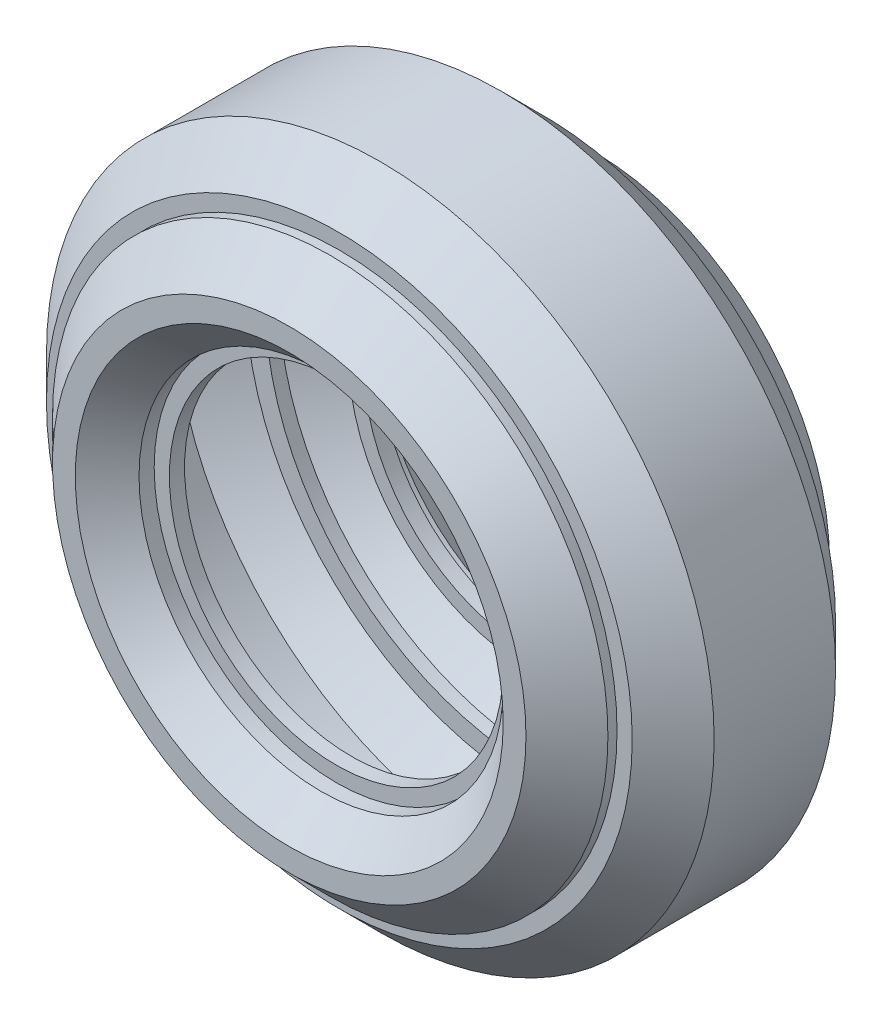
SolidWorks part; units mm, degrees
ref_plane "Front Plane" through (0, 0, 0) normal (0, 0, 1) x (1, 0, 0)
ref_plane "Top Plane" through (0, 0, 0) normal (0, 1, 0) x (1, 0, 0)
ref_plane "Right Plane" through (0, 0, 0) normal (1, 0, 0) x (0, 0, -1)
sketch "Sketch1" plane through (0, 0, 0) normal (0, 1, 0) x (1, 0, 0)
  line L0 (-7.62, 3.81) -> (0, 3.81)
  line L1 (-7.62, -3.81) -> (0, -3.81)
  circle A0 centre (0, 0) radius 2.286 construction
  arc A1 (0, -3.81) -> (0, 3.81) centre (0, 0) ccw
  arc A2 (-7.62, 3.81) -> (-7.62, -3.81) centre (-7.62, 0) ccw
  dimension "D1" = 7.62
  dimension "D2" = 4.572
  dimension "D3" = 7.62
extrude "Extrude1" add sketch "Sketch1" along normal blind 3.81
ref_plane "Plane1" through (0, 0, 3.81) normal (0, 0, 1) x (1, 0, 0)
sketch "Sketch4" plane through (0, 0, 3.81) normal (0, 0, 1) x (1, 0, 0)
  line L0 (0, 0) -> (0, 3.81)
  line L2 (0, 3.81) -> (7.62, 3.81)
  line L4 (7.62, 0) -> (0, 0)
  line L5 (7.62, 0) -> (11.43, 0)
  arc A0 (11.43, 0) -> (7.62, 3.81) centre (7.62, 0) ccw
  dimension "D2" = 3.81
  dimension "D1" = 7.62
extrude "Extrude2" add sketch "Sketch4" against normal blind 0.508
sketch "Sketch6" plane through (0, 0, 3.81) normal (0, 0, 1) x (1, 0, 0)
  line L0 (6.858, 2.032) -> (6.858, 1.016)
  line L1 (6.604, 0.762) -> (5.588, 0.762)
  line L2 (5.334, 0.508) -> (5.334, -0.508)
  line L3 (5.588, -0.762) -> (6.604, -0.762)
  line L4 (6.858, -1.016) -> (6.858, -2.032)
  line L5 (7.112, -2.286) -> (8.128, -2.286)
  line L6 (8.382, -2.032) -> (8.382, -1.016)
  line L7 (8.636, -0.762) -> (9.652, -0.762)
  line L8 (9.906, -0.508) -> (9.906, 0.508)
  line L9 (9.652, 0.762) -> (8.636, 0.762)
  line L10 (8.382, 1.016) -> (8.382, 2.032)
  line L11 (8.128, 2.286) -> (7.112, 2.286)
  line L12 (7.62, 1.454) -> (7.62, -1.454) construction
  line L13 (3.4212, 0) -> (11.8188, 0) construction
  arc A0 (6.858, 1.016) -> (6.604, 0.762) centre (6.604, 1.016) cw
  arc A1 (6.858, 2.032) -> (7.112, 2.286) centre (7.112, 2.032) cw
  arc A2 (8.128, 2.286) -> (8.382, 2.032) centre (8.128, 2.032) cw
  arc A3 (8.382, 1.016) -> (8.636, 0.762) centre (8.636, 1.016) ccw
  arc A4 (9.652, 0.762) -> (9.906, 0.508) centre (9.652, 0.508) cw
  arc A5 (9.652, -0.762) -> (9.906, -0.508) centre (9.652, -0.508) ccw
  arc A6 (8.636, -0.762) -> (8.382, -1.016) centre (8.636, -1.016) ccw
  arc A7 (8.382, -2.032) -> (8.128, -2.286) centre (8.128, -2.032) cw
  arc A8 (7.112, -2.286) -> (6.858, -2.032) centre (7.112, -2.032) cw
  arc A9 (6.604, -0.762) -> (6.858, -1.016) centre (6.604, -1.016) cw
  arc A10 (5.588, -0.762) -> (5.334, -0.508) centre (5.588, -0.508) cw
  arc A11 (5.334, 0.508) -> (5.588, 0.762) centre (5.588, 0.508) cw
  arc A13 (11.43, 0) -> (7.62, 3.81) centre (7.62, 0) ccw construction
  point P40 (7.62, 0)
  dimension "D6" = 0.254
  dimension "D1" = 4.572
  dimension "D2" = 4.572
  dimension "D3" = 1.524
  dimension "D4" = 1.524
  dimension "D5" = 1.524
extrude "Cut-Extrude2" cut sketch "Sketch6" against normal through all
sketch "Sketch8" plane through (0, 0, 3.302) normal (0, 0, -1) x (-1, 0, 0)
  line L0 (-10.795, 0) -> (-10.414, 0)
  line L1 (-4.826, 0) -> (-4.445, 0)
  line L2 (-7.62, 0) -> (-7.62, 5.3462) construction
  line L4 (-8.001, 2.7679) -> (-8.001, 3.1521)
  line L6 (-7.239, 2.7679) -> (-7.239, 3.1521)
  arc A0 (-4.445, 0) -> (-7.239, 3.1521) centre (-7.62, 0) ccw
  arc A1 (-4.826, 0) -> (-7.239, 2.7679) centre (-7.62, 0) ccw
  arc A2 (-8.001, 3.1521) -> (-10.795, 0) centre (-7.62, 0) ccw
  arc A3 (-8.001, 2.7679) -> (-10.414, 0) centre (-7.62, 0) ccw
  dimension "D1" = 5.588
  dimension "D2" = 6.35
  dimension "D3" = 0.762
extrude "Extrude3" add sketch "Sketch8" along normal blind 3.302
sketch "Sketch9" plane through (0, 0, 0) normal (0, 0, -1) x (-1, 0, 0)
  line L0 (-4.826, 0) -> (-4.445, 0) construction
  line L2 (-4.6355, 0) -> (-1.0818, 0)
  line L3 (-4.6355, 0) -> (-4.6355, 0.1905)
  line L4 (-4.6355, 0.1905) -> (-1.0818, 0.1905)
  line L5 (-1.0818, 0) -> (-1.0818, 0.1905)
  dimension "D1" = 0.1905
extrude "Extrude4" add sketch "Sketch9" against normal through all
mirror "Mirror5" about plane through (7.62, 0, 0) normal (0, 0, -1) of "Cut-Extrude2", "Extrude3", "Extrude2", "Extrude4"
sketch "Sketch11" plane through (0, 3.81, 0) normal (0, 1, 0) x (1, 0, 0)
  circle A0 centre (0, 0) radius 2.286
  circle A1 centre (-7.62, 0) radius 2.286
  arc A2 (-7.62, 3.81) -> (-7.62, -3.81) centre (-7.62, 0) ccw construction
  dimension "D1" = 4.572
extrude "Cut-Extrude3" cut sketch "Sketch11" against normal through all
sketch "Sketch12" plane through (0, 3.81, 0) normal (0, 1, 0) x (1, 0, 0)
  circle A0 centre (0, 0) radius 3.175
  circle A1 centre (-7.62, 0) radius 3.175
  dimension "D1" = 6.35
extrude "Cut-Extrude4" cut sketch "Sketch12" against normal blind 0.508
mirror "Mirror6"
sketch "Sketch13" plane through (0, 0, 3.81) normal (0, 0, 1) x (1, 0, 0)
  circle A0 centre (7.62, 0) radius 3.81
extrude "Cut-Extrude5" cut sketch "Sketch13" against normal through all flip side to cut
sketch "Sketch15" plane through (0, 0, -3.302) normal (0, 0, 1) x (1, 0, 0)
  line L1 (4.486, 2.1667) -> (5.2992, 2.1667)
  line L3 (4.492, -2.1753) -> (5.3073, -2.1753)
  arc A0 (4.486, 2.1667) -> (4.492, -2.1753) centre (7.62, 0) ccw
  arc A1 (5.2992, 2.1667) -> (5.3073, -2.1753) centre (7.62, 0) ccw
extrude "Cut-Extrude7" cut sketch "Sketch15" along normal up to surface (6.604 mm away)
scale "Scale1" scale about origin uniform scaling no x scale factor 1 y scale factor 1 z scale factor 2.633333
sketch "Sketch18" plane through (0, 0, -10.033) normal (0, 0, -1) x (-1, 0, 0)
  line L0 (-7.62, 2.286) -> (-7.62, -2.286) construction
  line L1 (-8.128, 2.286) -> (-7.112, 2.286) construction
  line L2 (-8.128, -2.286) -> (-7.112, -2.286) construction
  point P6 (-7.62, 0)
sketch "Sketch17" plane through (0, 0, 0) normal (0, 1, 0) x (1, 0, 0)
  line L0 (10.414, 10.033) -> (10.414, -10.033)
  line L1 (10.414, -10.033) -> (22.86, -10.033)
  line L2 (22.86, 10.033) -> (22.86, 8.763)
  line L3 (22.86, 8.763) -> (21.59, 8.763)
  line L4 (22.86, 10.033) -> (10.414, 10.033)
  line L5 (0, 0) -> (22.5835, 0) construction
  line L6 (21.59, 8.763) -> (21.59, 7.493)
  line L7 (21.59, 7.493) -> (22.86, 7.493)
  line L8 (22.86, 7.493) -> (22.86, 6.223)
  line L9 (22.86, 6.223) -> (21.59, 2.54)
  line L10 (21.59, 2.54) -> (21.59, -2.54)
  line L11 (22.86, -6.223) -> (21.59, -2.54)
  line L12 (22.86, -6.223) -> (22.86, -7.493)
  line L13 (22.86, -7.493) -> (21.59, -7.493)
  line L14 (21.59, -7.493) -> (21.59, -8.763)
  line L15 (21.59, -8.763) -> (22.86, -8.763)
  line L16 (22.86, -8.763) -> (22.86, -10.033)
  line L17 (7.62, 0) -> (7.62, 13.8284) construction
  dimension "D1" = 20.066
  dimension "D2" = 1.27
  dimension "D3" = 1.27
  dimension "D4" = 1.27
  dimension "D5" = 5.08
  dimension "D6" = 1.27
  dimension "D7" = 15.24
  dimension "D8" = 12.446
revolve "Revolve1" add sketch "Sketch17" angle 360 about L17
sketch "Sketch20" plane through (0, 0, 0) normal (0, 0, 1) x (1, 0, 0)
  line L0 (7.62, 0) -> (7.62, 15.2143) construction
  circle A0 centre (7.62, 7.62) radius 2.286
  circle A1 centre (7.62, 0) radius 7.62 construction
  circle A2 centre (14.2191, 3.81) radius 2.286
  circle A3 centre (14.2191, -3.81) radius 2.286
  circle A4 centre (7.62, -7.62) radius 2.286
  circle A5 centre (1.0209, -3.81) radius 2.286
  circle A6 centre (1.0209, 3.81) radius 2.286
  dimension "D1" = 15.24
  dimension "D2" = 4.572
extrude "Extrude6" cut sketch "Sketch20" against normal through all and the other way through all
sketch "Sketch21" plane through (0, 0, 10.033) normal (0, 0, 1) x (1, 0, 0)
  circle A0 centre (7.62, 0) radius 12.7
  circle A2 centre (7.62, 0) radius 3.81
  dimension "D1" = 7.62
  dimension "D2" = 25.4
extrude "Extrude7" cut sketch "Sketch21" against normal blind 10.16 draft 35
mirror "Mirror7" about plane through (0, 0, 0) normal (0, 0, 1) of "Extrude7"
sketch "Sketch22" plane through (0, 0, 0) normal (0, 1, 0) x (1, 0, 0)
  line L0 (22.86, -8.763) -> (22.86, -10.033) construction
  line L1 (21.59, -8.763) -> (22.86, -8.763) construction
  line L2 (21.59, -7.493) -> (21.59, -8.763) construction
  line L3 (22.86, -7.493) -> (21.59, -7.493) construction
  line L4 (22.86, -6.223) -> (22.86, -7.493) construction
  line L5 (22.86, -6.223) -> (21.59, -2.54) construction
  line L6 (21.59, 2.54) -> (21.59, -2.54) construction
  line L7 (22.86, 6.223) -> (21.59, 2.54) construction
  line L8 (22.86, 7.493) -> (22.86, 6.223) construction
  line L9 (21.59, 7.493) -> (22.86, 7.493) construction
  line L10 (21.59, 8.763) -> (21.59, 7.493) construction
  line L11 (22.86, 8.763) -> (21.59, 8.763) construction
  line L12 (22.86, 10.033) -> (22.86, 8.763) construction
  line L13 (22.86, -8.763) -> (22.86, -10.033)
  line L14 (21.59, -8.763) -> (22.86, -8.763)
  line L15 (21.59, -7.493) -> (21.59, -8.763)
  line L16 (22.86, -7.493) -> (21.59, -7.493)
  line L17 (22.86, -6.223) -> (22.86, -7.493)
  line L18 (22.86, -6.223) -> (21.59, -2.54)
  line L19 (21.59, 2.54) -> (21.59, -2.54)
  line L20 (22.86, 6.223) -> (21.59, 2.54)
  line L21 (22.86, 7.493) -> (22.86, 6.223)
  line L22 (21.59, 7.493) -> (22.86, 7.493)
  line L23 (21.59, 8.763) -> (21.59, 7.493)
  line L24 (22.86, 8.763) -> (21.59, 8.763)
  line L25 (22.86, 10.033) -> (22.86, 8.763)
  line L26 (0, 0) -> (22.5835, 0) construction
  line L27 (0, 0) -> (22.5835, 0) construction
  line L28 (22.86, 10.033) -> (25.527, 12.7)
  line L29 (25.527, 12.7) -> (27.432, 12.7)
  line L30 (27.432, 12.7) -> (30.861, 9.271)
  line L31 (30.861, 9.271) -> (30.861, 8.509)
  line L32 (30.861, 8.509) -> (32.131, 8.509)
  line L33 (32.131, 8.509) -> (35.56, 5.08)
  line L34 (35.56, 5.08) -> (35.56, -5.08)
  line L35 (35.56, -5.08) -> (32.131, -8.509)
  line L36 (32.131, -8.509) -> (30.861, -8.509)
  line L37 (30.861, -8.509) -> (30.861, -9.271)
  line L38 (30.861, -9.271) -> (27.432, -12.7)
  line L39 (27.432, -12.7) -> (25.527, -12.7)
  line L40 (25.527, -12.7) -> (22.86, -10.033)
  line L41 (7.62, 0) -> (7.62, 13.8284) construction
  dimension "D1" = 27.94
  dimension "D2" = 25.4
  dimension "D3" = 135
  dimension "D4" = 10.16
  dimension "D5" = 1.27
  dimension "D6" = 1.905
revolve "Revolve2" add sketch "Sketch22" angle 360 about L17
delete or keep bodies "Body-Delete1" type delete bodies bodies 126
shell "Shell1" thickness 0.635
